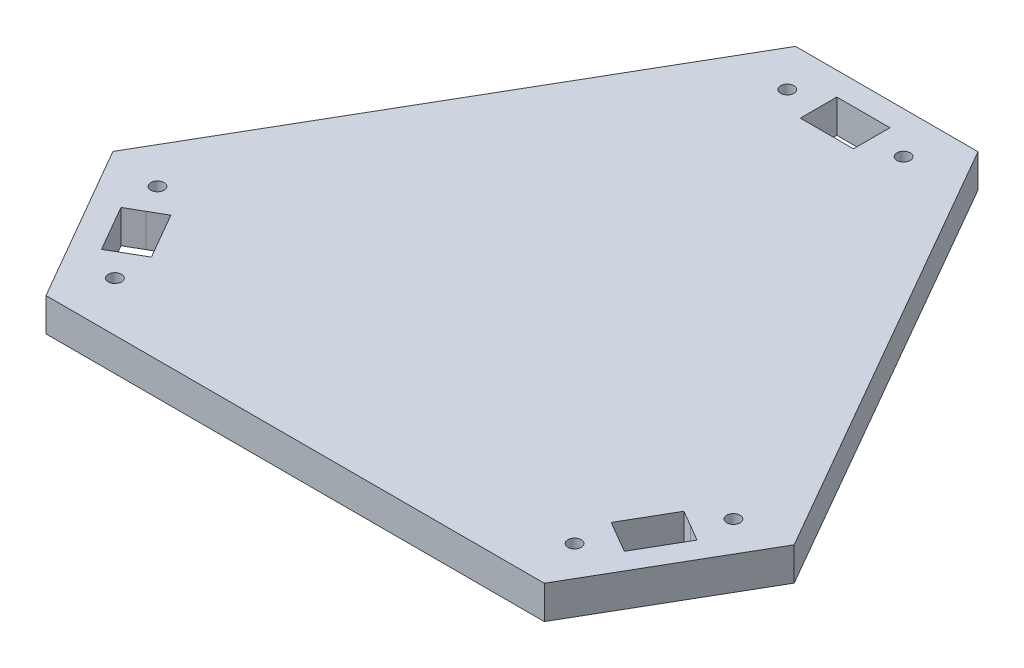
SolidWorks part; units mm, degrees
ref_plane "Ebene vorne" through (0, 0, 0) normal (0, 0, 1) x (1, 0, 0)
ref_plane "Ebene oben" through (0, 0, 0) normal (0, 1, 0) x (1, 0, 0)
ref_plane "Ebene rechts" through (0, 0, 0) normal (1, 0, 0) x (0, 0, -1)
sketch "Skizze1" plane through (0, 0, 0) normal (0, 1, 0) x (1, 0, 0)
  line L0 (-149.9886, 0) -> (150.0755, 0)
  line L1 (-54.2372, 355.613) -> (-204.9943, 95.3014)
  line L4 (205.2183, 95.3014) -> (55.5843, 355.613)
  line L5 (-54.2372, 355.613) -> (55.5843, 355.613)
  line L6 (205.2183, 95.3014) -> (150.0755, 0)
  line L7 (-149.9886, 0) -> (-204.9943, 95.3014)
extrude "Aufsatz-Linear austragen1" add sketch "Skizze1" along normal blind 20 contours L1 L7 L0 L6 L4 L5
sketch "Skizze2" plane through (0, 20, 0) normal (0, 1, 0) x (1, 0, 0)
  line L0 (205.2183, 95.3014) -> (150.0755, 0) construction
  circle A0 centre (173.5106, 90.4201) radius 4
  circle A1 centre (138.4531, 29.8315) radius 4
  dimension "D3" = 70
  dimension "D1" = 25
  dimension "D2" = 25
sketch "Skizze4" plane through (0, 20, 0) normal (0, 1, 0) x (1, 0, 0)
  line L0 (-54.2372, 355.613) -> (55.5843, 355.613) construction
  circle A0 centre (-34.2372, 330.613) radius 4
  circle A1 centre (35.7628, 330.613) radius 4
  dimension "D1" = 25
  dimension "D2" = 25
  dimension "D3" = 70
sketch "Skizze5" plane through (0, 20, 0) normal (0, 1, 0) x (1, 0, 0)
  line L0 (-149.9886, 0) -> (-204.9943, 95.3014) construction
  circle A0 centre (-173.3443, 90.4768) radius 4
  circle A1 centre (-138.3522, 29.8504) radius 4
  dimension "D1" = 25
  dimension "D2" = 25
  dimension "D3" = 70
sketch "Skizze7" plane through (0, 20, 0) normal (0, 1, 0) x (1, 0, 0)
  line L0 (-163.8464, 74.021) -> (-173.3734, 68.5223)
  line L3 (-147.8319, 46.2747) -> (-138.3049, 51.7735)
  line L4 (-138.3049, 51.7735) -> (-154.3013, 79.4884)
  line L5 (-154.3013, 79.4884) -> (-163.8464, 74.021)
  line L6 (-173.3734, 68.5223) -> (-157.377, 40.8074)
  line L7 (-157.377, 40.8074) -> (-147.8319, 46.2747)
  dimension "D3" = 11
  dimension "D6" = 32
extrude "Schnitt-Linear austragen7" cut sketch "Skizze7" against normal blind 20
sketch "Skizze8" plane through (0, 20, 0) normal (0, 1, 0) x (1, 0, 0)
  line L0 (164.0475, 74.0654) -> (154.5264, 79.5744)
  line L3 (147.9687, 46.277) -> (157.4898, 40.768)
  line L4 (154.5264, 79.5744) -> (138.5002, 51.8768)
  line L5 (138.5002, 51.8768) -> (147.9687, 46.277)
  line L6 (157.4898, 40.768) -> (173.516, 68.4656)
  line L7 (173.516, 68.4656) -> (164.0475, 74.0654)
  dimension "D4" = 11
  dimension "D5" = 32
extrude "Schnitt-Linear austragen8" cut sketch "Skizze8" against normal blind 20
sketch "Skizze11" plane through (0, 20, 0) normal (0, 1, 0) x (1, 0, 0)
  line L0 (-15.4157, 330.613) -> (-15.4157, 319.613)
  line L3 (-15.4157, 319.613) -> (16.5843, 319.613)
  line L4 (16.5843, 319.613) -> (16.5843, 341.613)
  line L5 (16.5843, 341.613) -> (-15.4157, 341.613)
  line L6 (-15.4157, 341.613) -> (-15.4157, 330.613)
  dimension "D1" = 32
  dimension "D4" = 22
extrude "Schnitt-Linear austragen9" cut sketch "Skizze11" against normal blind 20
extrude "Schnitt-Linear austragen10" cut sketch "Skizze2" against normal blind 10
extrude "Schnitt-Linear austragen11" cut sketch "Skizze4" against normal blind 10
extrude "Schnitt-Linear austragen12" cut sketch "Skizze5" against normal blind 10
